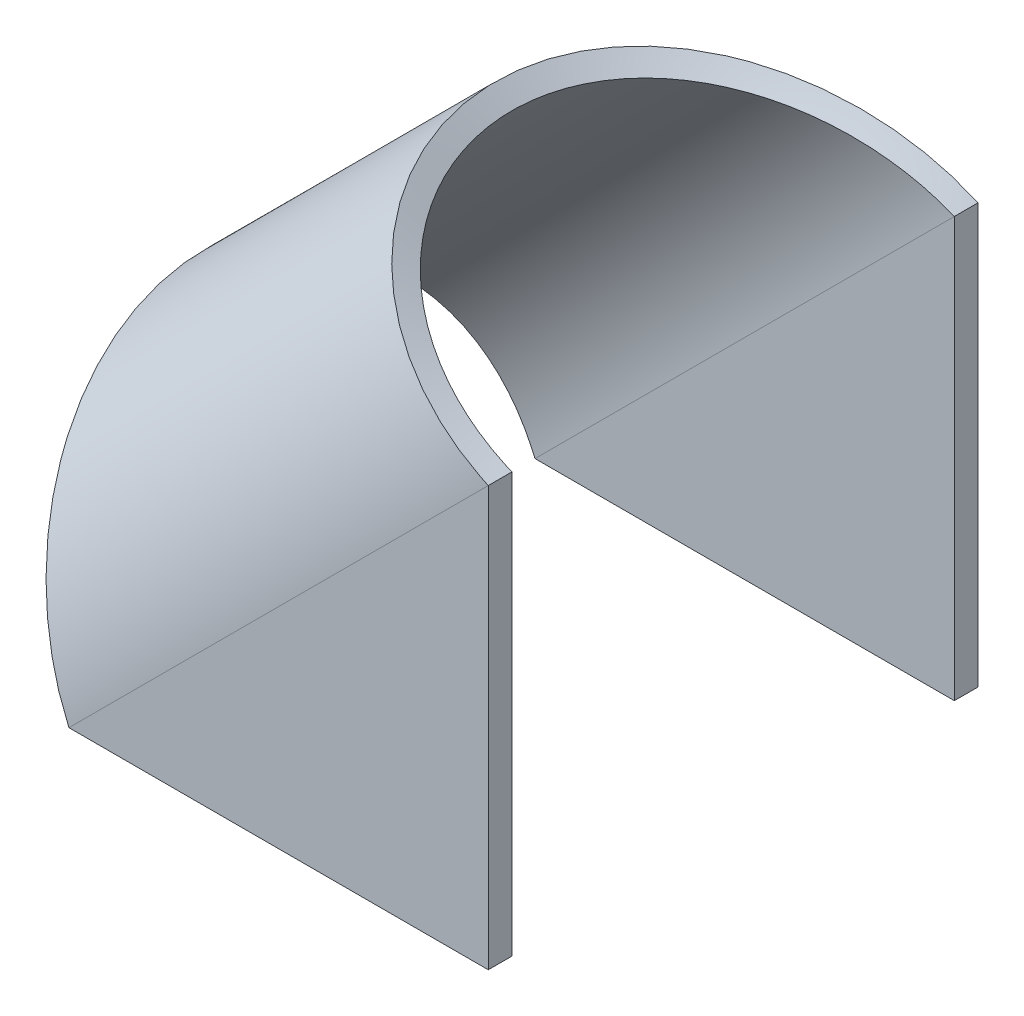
SolidWorks part; units mm, degrees
ref_plane "前视基准面" through (0, 0, 0) normal (0, 0, 1) x (1, 0, 0)
ref_plane "上视基准面" through (0, 0, 0) normal (0, 1, 0) x (1, 0, 0)
ref_plane "右视基准面" through (0, 0, 0) normal (1, 0, 0) x (0, 0, -1)
imported_body "基体零件-带补料的垂直四通管-1"
sheet metal parameters "钣金1" parameters "D1"=0.7366, "厚度"=1
bend "圆角折弯1" bend radius 9.3514 bend angle 180 parameters "D5"=1
flatten bends "展开-折弯1"
sketch "尖角-草图1" plane through (0, 0, -9.3514) normal (0, 0, 1) x (1, 0, 0)
  line L0 (-10.3868, 28.115) -> (-28.115, 10.3868) construction
  dimension "D1" = 0
process bends "加工-折弯1" parameters "D1"=0
sketch "平面-草图1" plane through (0, 0, -9.3514) normal (0, 0, 1) x (1, 0, 0)
flat pattern "平板型式1"
sketch "折弯-线1" plane through (0, 0, 0) normal (0, 1, 0) x (-1, 0, 0)
bend of the flat pattern "展开-<圆角折弯1>1"
